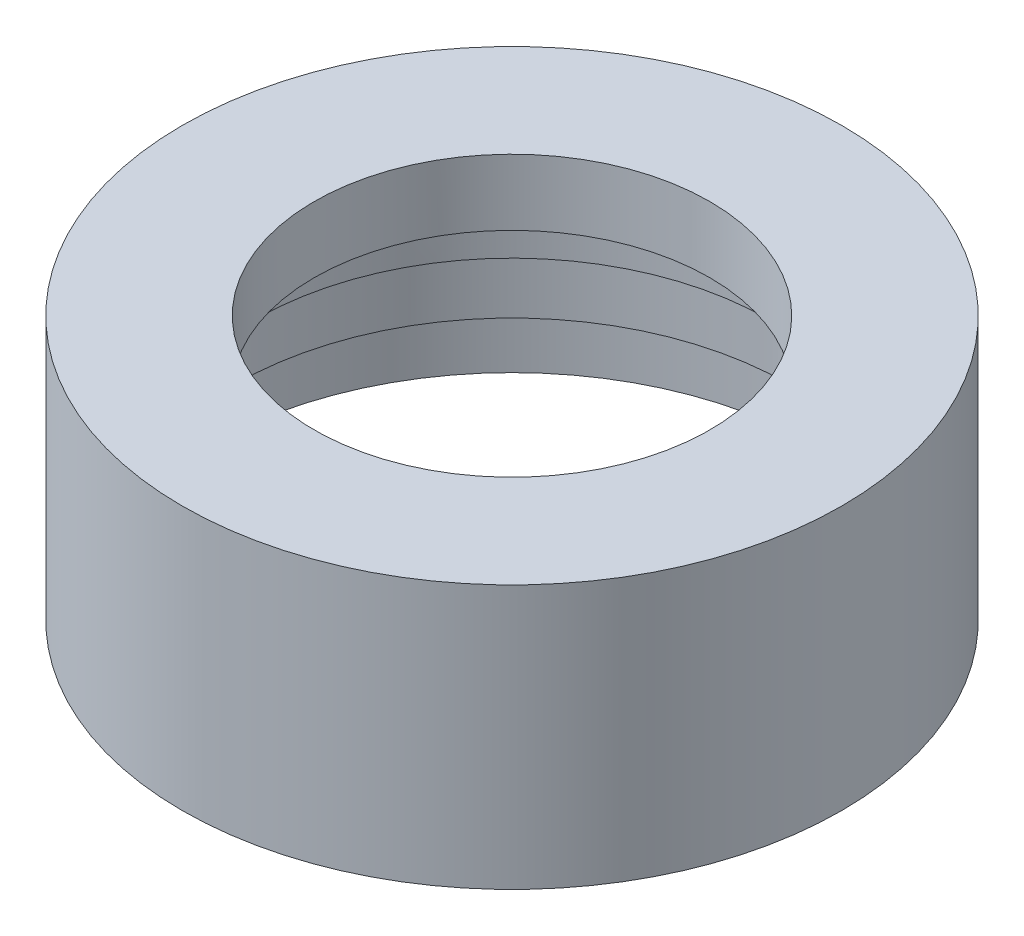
SolidWorks part; units mm, degrees
ref_plane "Front Plane" through (0, 0, 0) normal (0, 0, 1) x (1, 0, 0)
ref_plane "Top Plane" through (0, 0, 0) normal (0, 1, 0) x (1, 0, 0)
ref_plane "Right Plane" through (0, 0, 0) normal (1, 0, 0) x (0, 0, -1)
sketch "Sketch1" plane through (0, 0, 0) normal (0, 0, 1) x (1, 0, 0)
  line L0 (-130.5353, 2.9577) -> (-130.4791, 8.483)
  line L1 (-130.4791, 8.483) -> (-130.4791, -4.4164) construction
  line L2 (-105.7835, -11.8798) -> (-105.7835, 18.2865) construction
  line L3 (-130.5041, 8.4789) -> (-130.4791, 8.483)
  line L4 (-135.3836, -9.7423) -> (-134.9935, -9.7423)
  line L5 (-134.9935, -9.7423) -> (-134.9935, -3.411)
  line L6 (-130.5353, 2.9577) -> (-132.4535, 2.9577)
  line L7 (-132.4535, 2.9577) -> (-132.4535, -3.3923)
  line L8 (-132.4535, -3.3923) -> (-134.9935, -3.3923)
  line L9 (-134.9935, -3.3923) -> (-134.9935, -3.411)
  line L10 (-130.5041, 8.4789) -> (-124.8335, 9.3077)
  line L12 (-135.3836, -9.7423) -> (-137.5335, -9.7423)
  line L13 (-137.5335, -9.7423) -> (-137.5335, 15.6577)
  line L14 (-137.5335, 15.6577) -> (-124.8335, 15.6577)
  line L15 (-124.8335, 15.6577) -> (-124.8335, 9.3077)
  arc A0 (-124.8335, 9.3077) -> (-130.4791, 8.483) centre (-105.7835, -140.8469) ccw
  dimension "D1" = 63.5
  dimension "D2" = 53.34
  dimension "D3" = 58.42
  dimension "D4" = 81.103
  dimension "D5" = 38.1
  dimension "D6" = 25.4
  dimension "D7" = 19.05
  dimension "D8" = 12.7
  dimension "D9" = 6.35
revolve "Revolve1" add sketch "Sketch1" angle 360 about L2
